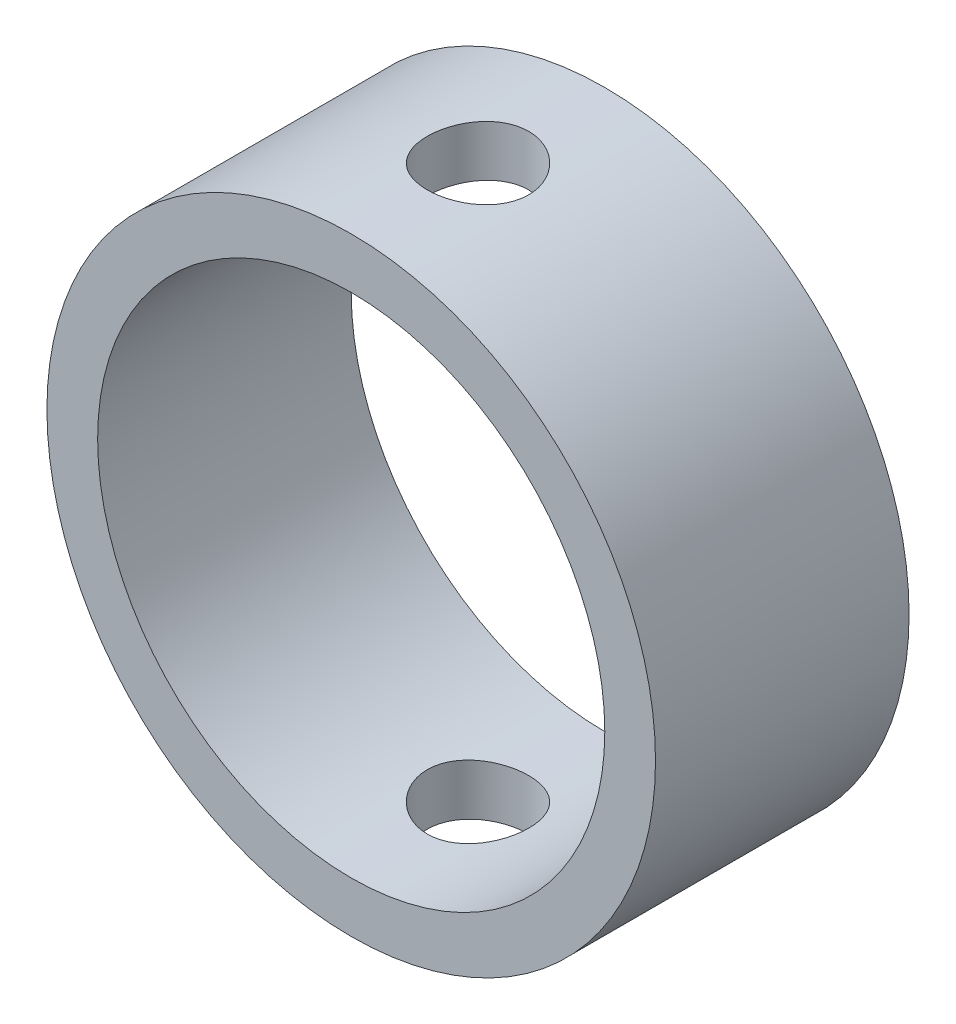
SolidWorks part; units mm, degrees
ref_plane "Ebene vorne" through (0, 0, 0) normal (0, 0, 1) x (1, 0, 0)
ref_plane "Ebene oben" through (0, 0, 0) normal (0, 1, 0) x (1, 0, 0)
ref_plane "Ebene rechts" through (0, 0, 0) normal (1, 0, 0) x (0, 0, -1)
sketch "Skizze1" plane through (0, 0, 0) normal (0, 0, 1) x (1, 0, 0)
  circle A0 centre (0, 0) radius 6
extrude "Linear austragen1" add sketch "Skizze1" along normal blind 5
sketch "Skizze2" plane through (0, 0, 5) normal (0, 0, 1) x (1, 0, 0)
  circle A0 centre (0, 0) radius 5
extrude "Schnitt-Linear austragen1" cut sketch "Skizze2" against normal blind 5
sketch "Skizze3" plane through (0, 0, 0) normal (0, 1, 0) x (1, 0, 0)
  line L1 (-6, -5) -> (6, -5) construction
  circle A0 centre (0, -2.5) radius 1
  dimension "D1" = 2.5
extrude "Schnitt-Linear austragen2" cut sketch "Skizze3" against normal blind 10 and the other way blind 60
